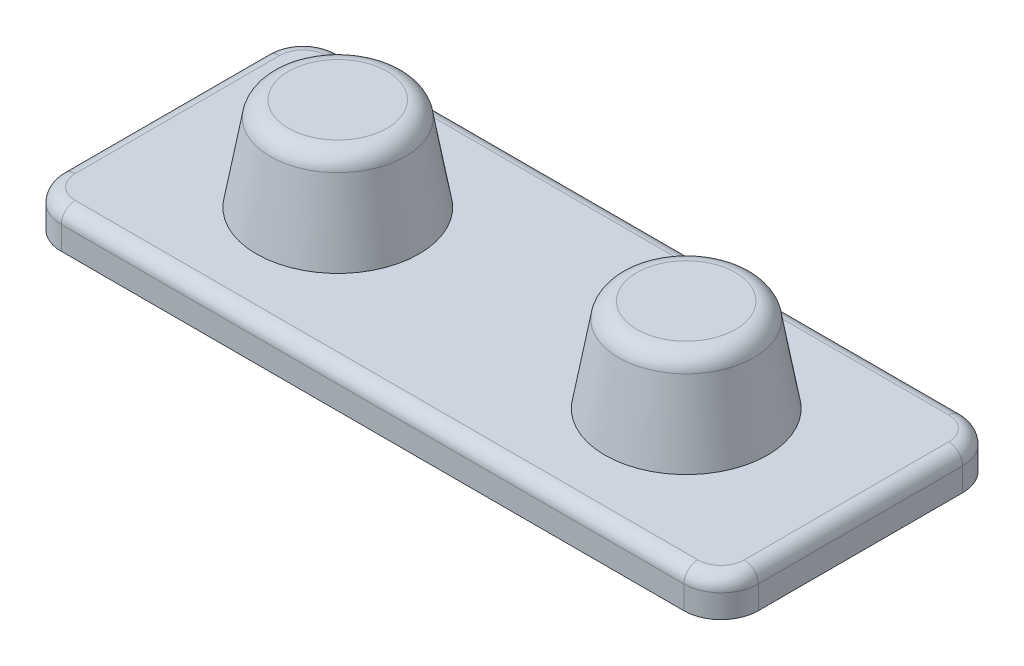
SolidWorks part; units mm, degrees
ref_plane "Front" through (0, 0, 0) normal (0, 0, 1) x (1, 0, 0)
ref_plane "Top" through (0, 0, 0) normal (0, 1, 0) x (1, 0, 0)
ref_plane "Right" through (0, 0, 0) normal (1, 0, 0) x (0, 0, -1)
sketch "Sketch2" plane through (0, 0, 0) normal (0, 1, 0) x (1, 0, 0)
  line L1 (75, -30) -> (-75, -30)
  line L2 (75, -30) -> (75, 30)
  line L3 (75, 30) -> (-75, 30)
  line L4 (-75, -30) -> (-75, 30)
  line L5 (75, -30) -> (-75, 30) construction
  line L6 (75, 30) -> (-75, -30) construction
  point P0 (0, 0)
  dimension "D1" = 150
  dimension "D2" = 60
extrude "Boss-Extrude1" add sketch "Sketch2" along normal blind 8
fillet "Fillet1" radius 8 4 edges at (-75, 4, -30) (75, 4, -30) (75, 4, 30) (-75, 4, 30)
fillet "Fillet2" radius 3 8 edges at (72.6569, 8, -27.6569) (75, 8, 0) (72.6569, 8, 27.6569) (0, 8, 30) (-72.6569, 8, 27.6569) (-75, 8, 0) (-72.6569, 8, -27.6569) (0, 8, -30)
sketch "Sketch3" plane through (0, 8, 0) normal (0, 1, 0) x (1, 0, 0)
  line L0 (-37.5, 0) -> (37.5, 0) construction
  circle A0 centre (-37.5, 0) radius 17.5
  circle A1 centre (37.5, 0) radius 17.5
  dimension "D2" = 35
  dimension "D1" = 75
extrude "Boss-Extrude2" add sketch "Sketch3" along normal blind 20 draft 10
fillet "Fillet3" radius 4 2 edges at (37.5, 28, 13.9735) (-37.5, 28, 13.9735)
shell "Shell1" thickness 2
sketch "Sketch4" plane through (0, 0, 0) normal (0, -1, 0) x (1, 0, 0)
  line L0 (-17.5, 0) -> (17.5, 0)
  line L3 (0, 28) -> (0, -28)
  line L4 (-67, 28) -> (67, 28) construction
  line L6 (67, -28) -> (-67, -28) construction
  circle A0 centre (-37.5, 0) radius 20
  circle A1 centre (37.5, 0) radius 20
  dimension "D1" = 40
rib "Rib1" sketch "Sketch4" sketch "Sketch4" thickness 2 extrusion direction normal to sketch draft on no parameters "D1"=2
sketch "Sketch5" plane through (0, 0, 0) normal (0, -1, 0) x (1, 0, 0)
  line L0 (-72.7729, 20.3648) -> (-55.6865, 10.5)
  line L1 (-55.6865, 10.5) -> (-37.5, 0) construction
  line L2 (-37.5, 0) -> (-73, 0) construction
  line L3 (-73, -22) -> (-73, 22) construction
  line L4 (-72.7729, -20.3648) -> (-55.6865, -10.5)
  arc A1 (-16.5238, 1) -> (-16.5238, -1) centre (-37.5, 0) ccw construction
  arc A2 (-67, 28) -> (-73, 22) centre (-67, 22) ccw construction
  dimension "D1" = 30
rib "Rib2" sketch "Sketch5" sketch "Sketch5" thickness 2 extrusion direction normal to sketch draft on no parameters "D1"=2
mirror "Mirror1" about plane through (0, 0, 0) normal (1, 0, 0) of "Rib2"
